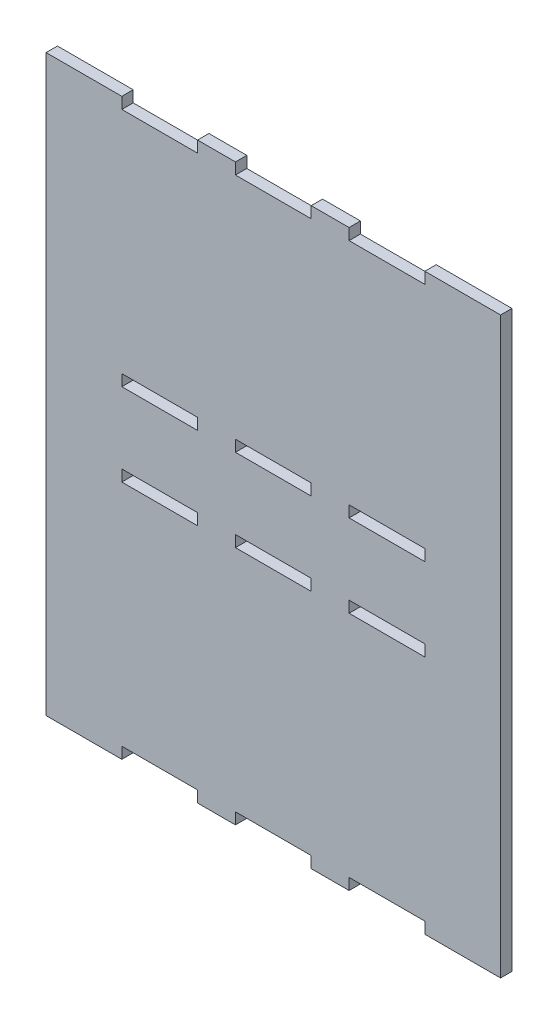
SolidWorks part; units mm, degrees
ref_plane "Plan de face" through (0, 0, 0) normal (0, 0, 1) x (1, 0, 0)
ref_plane "Plan de dessus" through (0, 0, 0) normal (0, 1, 0) x (1, 0, 0)
ref_plane "Plan de droite" through (0, 0, 0) normal (1, 0, 0) x (0, 0, -1)
sketch "Esquisse1" plane through (0, 0, 0) normal (0, 0, 1) x (1, 0, 0)
  line L0 (0, 0) -> (10, 0)
  line L1 (0, 0) -> (-10, 0)
  line L2 (10, 0) -> (10, 3)
  line L3 (-10, 0) -> (-10, 3)
  line L4 (10, 3) -> (20, 3)
  line L5 (-10, 3) -> (-20, 3)
  line L6 (-20, 3) -> (-20, 0)
  line L7 (20, 3) -> (20, 0)
  line L8 (20, 0) -> (40, 0)
  line L9 (-20, 0) -> (-40, 0)
  line L10 (-40, 0) -> (-40, 3)
  line L11 (40, 0) -> (40, 3)
  line L12 (40, 3) -> (60, 3)
  line L13 (-40, 3) -> (-60, 3)
  line L14 (60, 3) -> (60, -148.6)
  line L15 (-60, 3) -> (-60, -148.6)
  line L16 (60, -72.8) -> (-68.1289, -72.8) construction
  line L17 (-40, -148.6) -> (-60, -148.6)
  line L18 (-40, -145.6) -> (-40, -148.6)
  line L19 (-20, -145.6) -> (-40, -145.6)
  line L20 (-20, -148.6) -> (-20, -145.6)
  line L21 (-10, -148.6) -> (-20, -148.6)
  line L22 (-10, -145.6) -> (-10, -148.6)
  line L23 (0, -145.6) -> (-10, -145.6)
  line L24 (0, -145.6) -> (10, -145.6)
  line L25 (10, -145.6) -> (10, -148.6)
  line L26 (10, -148.6) -> (20, -148.6)
  line L27 (20, -148.6) -> (20, -145.6)
  line L28 (20, -145.6) -> (40, -145.6)
  line L29 (40, -145.6) -> (40, -148.6)
  line L30 (40, -148.6) -> (60, -148.6)
  line L31 (-60, -72.8) -> (-40, -72.8) construction
  line L32 (-40, -72.8) -> (-40, -63.4) construction
  line L33 (10, -63.4) -> (10, -60.4)
  line L34 (-40, -60.4) -> (-20, -60.4)
  line L36 (-40, -60.4) -> (-40, -63.5192)
  line L37 (-20, -63.4) -> (-10, -63.4) construction
  line L38 (-10, -63.4) -> (-10, -60.4)
  line L39 (-10, -60.4) -> (10, -60.4)
  line L41 (10, -63.4) -> (-10, -63.4)
  line L42 (0, -72.8) -> (0, -48.3118) construction
  line L43 (-40, -63.4) -> (-20, -63.4)
  line L44 (-20, -60.4) -> (-20, -63.4)
  line L45 (40, -60.4) -> (20, -60.4)
  line L46 (20, -60.4) -> (20, -63.4)
  line L47 (40, -63.4) -> (20, -63.4)
  line L48 (40, -60.4) -> (40, -63.4)
  line L49 (40, -85.2) -> (40, -82.2)
  line L50 (40, -82.2) -> (20, -82.2)
  line L51 (20, -85.2) -> (20, -82.2)
  line L52 (40, -85.2) -> (20, -85.2)
  line L53 (10, -82.2) -> (10, -85.2)
  line L54 (-10, -85.2) -> (10, -85.2)
  line L55 (-10, -82.2) -> (-10, -85.2)
  line L56 (10, -82.2) -> (-10, -82.2)
  line L57 (-40, -82.2) -> (-20, -82.2)
  line L58 (-20, -85.2) -> (-20, -82.2)
  line L59 (-40, -85.2) -> (-20, -85.2)
  line L60 (-40, -85.2) -> (-40, -82.2)
  point P47 (0, -63.4)
  point P48 (0, -60.4)
  dimension "D1" = 10
  dimension "D2" = 10
  dimension "D3" = 3
  dimension "D4" = 3
  dimension "D5" = 10
  dimension "D6" = 10
  dimension "D7" = 20
  dimension "D8" = 20
  dimension "D9" = 3
  dimension "D10" = 20
  dimension "D11" = 20
  dimension "D12" = 3
  dimension "D13" = 3
  dimension "D14" = 20
  dimension "D15" = 151.6
  dimension "D16" = 9.4
  dimension "D17" = 20
  dimension "D18" = 3
  dimension "D19" = 10
  dimension "D20" = 10
  dimension "D22" = 3
extrude "Boss.-Extru.1" add sketch "Esquisse1" along normal blind 3
